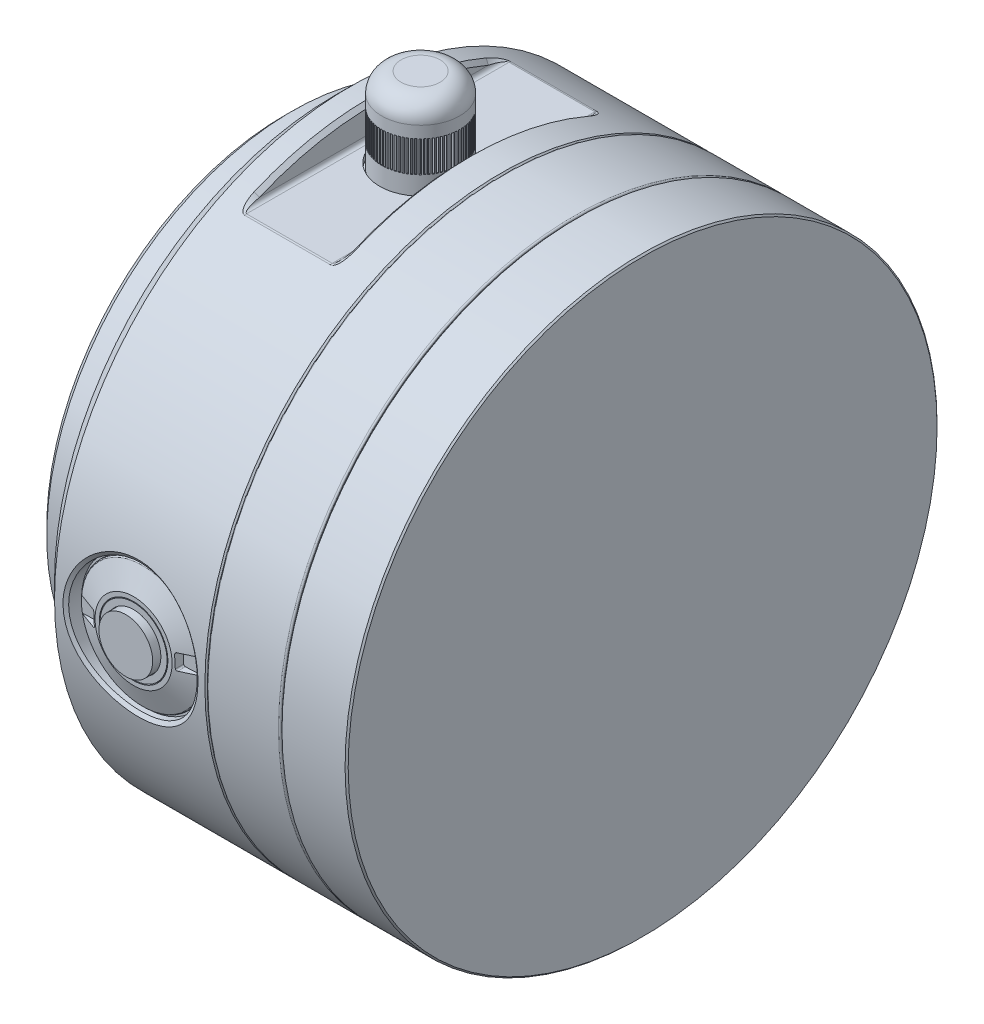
SolidWorks part; units mm, degrees
ref_plane "前视基准面" through (0, 0, 0) normal (0, 0, 1) x (1, 0, 0)
ref_plane "上视基准面" through (0, 0, 0) normal (0, 1, 0) x (1, 0, 0)
ref_plane "右视基准面" through (0, 0, 0) normal (1, 0, 0) x (0, 0, -1)
imported_body "C6末端法兰-1-solid1"
imported_body "航插组件-1/末端航插帽-C-1-solid1"
imported_body "C6散光环-1-solid1"
imported_body "C6末端法兰转接件-1-solid1"
imported_body "PBM-12Q12-HT-U4-R3.3-S7S-0004(L-40-1571#28-RBY-ZH-3P)-1-solid1"
imported_body "PBM-12Q12-HT-U4-R3.3-S7S-0004(L-40-1571#28-RBY-ZH-3P)-2-solid1"
combine bodies "组合1" operation type add bodies to combine 109 107 111 106 110 108
